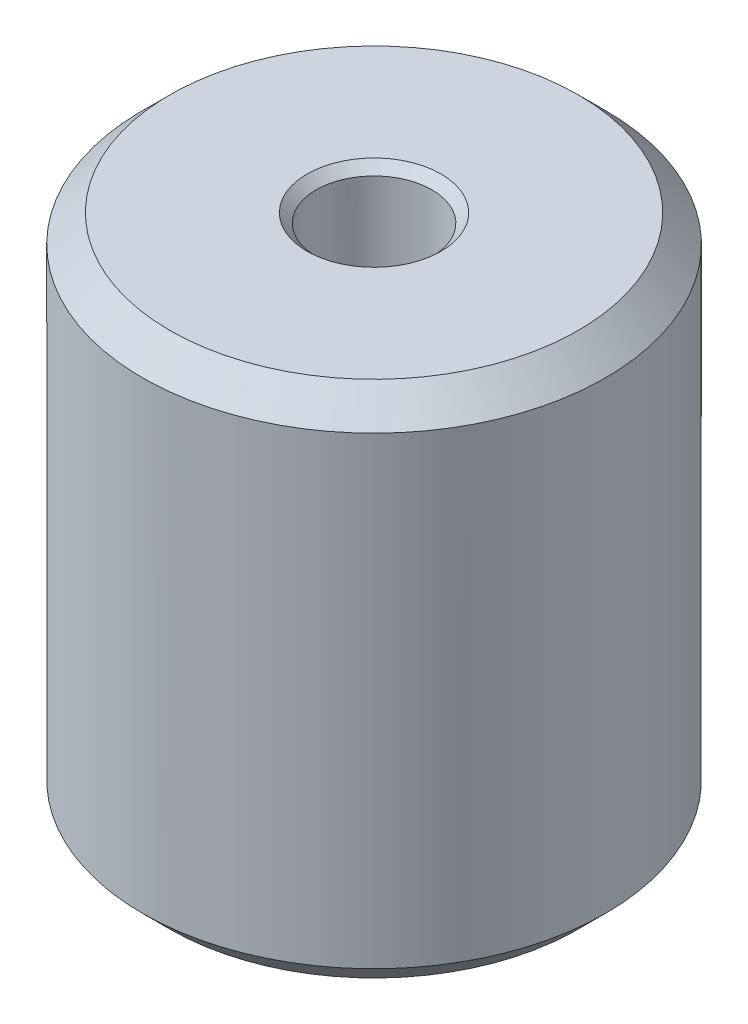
SolidWorks part; units mm, degrees
ref_plane "Front Plane" through (0, 0, 0) normal (0, 0, 1) x (1, 0, 0)
ref_plane "Top Plane" through (0, 0, 0) normal (0, 1, 0) x (1, 0, 0)
ref_plane "Right Plane" through (0, 0, 0) normal (1, 0, 0) x (0, 0, -1)
sketch "Sketch1" plane through (0, 0, 0) normal (0, 0, 1) x (1, 0, 0)
  line L0 (0, 0) -> (0, 59.1118) construction
  line L1 (-3.175, 0) -> (-3.175, 6.985)
  line L2 (-3.175, 6.985) -> (-1.5875, 6.985)
  line L3 (-1.5875, 6.985) -> (-1.5875, 14.224)
  line L4 (-1.5875, 14.224) -> (-6.35, 14.224)
  line L5 (-6.35, 14.224) -> (-6.35, 0)
  line L6 (-6.35, 0) -> (-3.175, 0)
  dimension "D1" = 6.985
  dimension "D2" = 14.224
  dimension "D3" = 6.35
  dimension "D4" = 3.175
  dimension "D5" = 12.7
revolve "Revolve1" add sketch "Sketch1" angle 360 about L0
chamfer "Chamfer1" distance 0.75 angle 45 2 edges at (0, 0, -6.35) (0, 14.224, -6.35)
chamfer "Chamfer2" distance 0.25 angle 45 2 edges at (0, 0, -3.175) (0, 14.224, -1.5875)
sketch "Sketch2" plane through (0, 0, 0) normal (1, 0, 0) x (0, 0, -1)
  line L0 (0, 14.224) -> (0, 0) construction
  line L1 (1.8375, 14.224) -> (-1.8375, 14.224) construction
  line L2 (5.6, 14.224) -> (-5.6, 14.224) construction
  line L3 (-5.6, 0) -> (5.6, 0) construction
  circle A0 centre (0, 10.668) radius 1.0922
  circle A1 centre (0, 3.56) radius 1.7272
  dimension "D1" = 2.1844
  dimension "D2" = 3.4544
  dimension "D3" = 3.556
  dimension "D4" = 3.56
extrude "Extrude1" cut sketch "Sketch2" against normal through all
ref_plane "Plane1" through (-6.35, 0, 0) normal (1, 0, 0) x (0, 0, -1)
sketch "Sketch3" plane through (-6.35, 0, 0) normal (1, 0, 0) x (0, 0, -1)
  circle A0 centre (0, 10.668) radius 1.0922 construction
  circle A1 centre (0, 10.668) radius 1.0922
  circle A2 centre (0, 3.56) radius 1.7272 construction
  circle A3 centre (0, 3.56) radius 1.7272
extrude "Extrude2" add sketch "Sketch3" along normal blind 2.54 separate body
sketch "Sketch4" plane through (-6.35, 0, 0) normal (-1, 0, 0) x (0, 0, 1)
  line L0 (0, 14.224) -> (0, 0) construction
  line L1 (5.6, 14.224) -> (-5.6, 14.224) construction
  line L3 (0.2222, 11.0529) -> (-0.2223, 11.0529)
  line L4 (-0.2223, 11.0529) -> (-0.4445, 10.668)
  line L5 (-0.4445, 10.668) -> (-0.2223, 10.2831)
  line L6 (-0.2223, 10.2831) -> (0.2222, 10.2831)
  line L7 (0.2222, 10.2831) -> (0.4445, 10.668)
  line L8 (0.4445, 10.668) -> (0.2222, 11.0529)
  line L9 (0.3969, 4.2474) -> (-0.3969, 4.2474)
  line L10 (-0.3969, 4.2474) -> (-0.7938, 3.56)
  line L11 (-0.7938, 3.56) -> (-0.3969, 2.8726)
  line L12 (-0.3969, 2.8726) -> (0.3969, 2.8726)
  line L13 (0.3969, 2.8726) -> (0.7937, 3.56)
  line L14 (0.7937, 3.56) -> (0.3969, 4.2474)
  circle A0 centre (0, 10.668) radius 0.4445 construction
  circle A1 centre (0, 3.56) radius 0.7938 construction
  circle A2 centre (0, 10.668) radius 0.3849 construction
  circle A3 centre (0, 3.56) radius 0.6874 construction
  dimension "D1" = 0.889
  dimension "D2" = 1.5875
extrude "Extrude3" cut sketch "Sketch4" against normal blind 1
